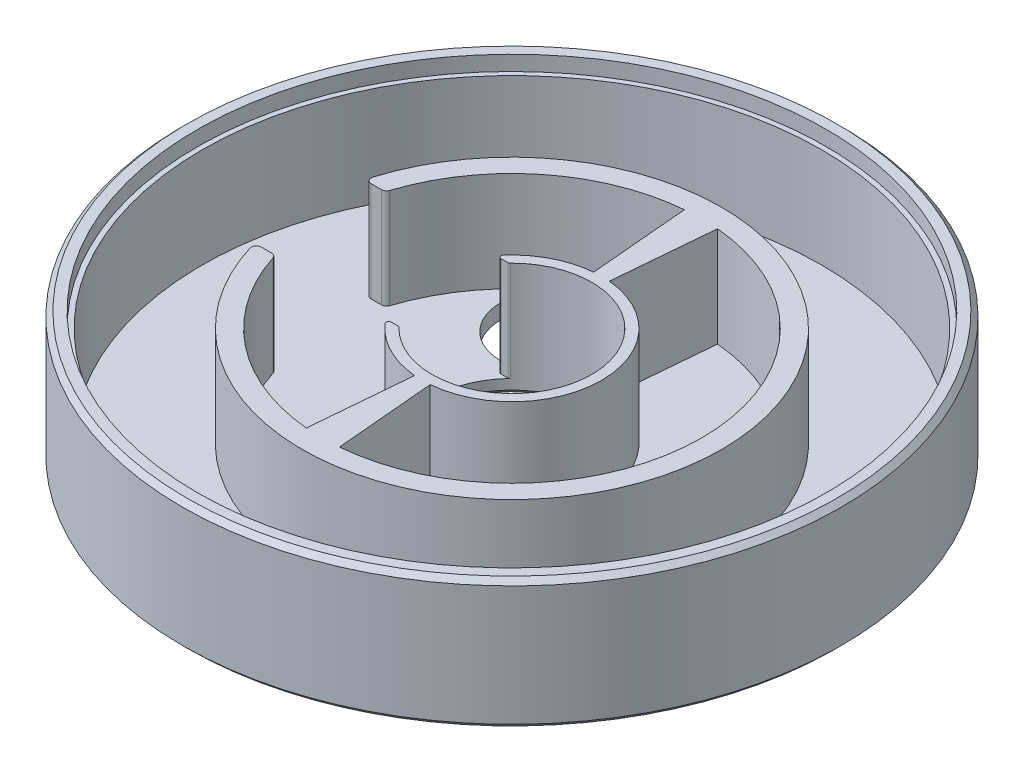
SolidWorks part; units mm, degrees
ref_plane "Front Plane" through (0, 0, 0) normal (0, 0, 1) x (1, 0, 0)
ref_plane "Top Plane" through (0, 0, 0) normal (0, 1, 0) x (1, 0, 0)
ref_plane "Right Plane" through (0, 0, 0) normal (1, 0, 0) x (0, 0, -1)
sketch "Sketch1" plane through (0, 0, 0) normal (0, 1, 0) x (1, 0, 0)
  circle A0 centre (0, 0) radius 8
  circle A1 centre (0, 0) radius 20 construction
  circle A2 centre (0, 0) radius 33
  circle A3 centre (0, 0) radius 14 construction
  circle A4 centre (0, 0) radius 26 construction
extrude "Boss-Extrude1" add sketch "Sketch1" against normal blind 13 contours A2 A1 | A1 A0
sketch "Sketch2" plane through (0, 0, 0) normal (0, 1, 0) x (1, 0, 0)
  circle A0 centre (0, 0) radius 31.5
extrude "Cut-Extrude1" cut sketch "Sketch2" against normal blind 1.5
ref_axis "Axis1" through (0, -13, 0) along (0, 1, 0)
sketch "Sketch4" plane through (0, 0, 0) normal (0, 0, 1) x (1, 0, 0)
  line L0 (-26, 0) -> (-26, -12.929) construction
  line L1 (26, 0) -> (-26, 0) construction
  line L2 (33, 0) -> (-33, 0) construction
  line L3 (-14, 0) -> (-14, -12.929) construction
  line L4 (14, 0) -> (-14, 0) construction
  line L5 (-26, 0) -> (-31, 0)
  line L6 (-31, 0) -> (-31, -11.5)
  line L7 (-31, -11.5) -> (-21, -11.5)
  line L8 (-21, -11.5) -> (-21, 0)
  line L9 (-21, 0) -> (-26, 0)
revolve "Cut-Revolve1" cut sketch "Sketch4" angle 360 about axis through (0, -13, 0) along (0, 1, 0)
sketch "Sketch5" plane through (0, 0, 0) normal (0, 0, 1) x (1, 0, 0)
  line L0 (-14, 0) -> (-19, 0)
  line L1 (26, 0) -> (-26, 0) construction
  line L2 (-19, 0) -> (-19, -11.5)
  line L3 (21, -11.5) -> (-21, -11.5) construction
  line L4 (-19, -11.5) -> (-9, -11.5)
  line L5 (-9, -11.5) -> (-9, 0)
  line L6 (-9, 0) -> (-14, 0)
revolve "Cut-Revolve3" cut sketch "Sketch5" angle 170 mid plane about axis through (0, -13, 0) along (0, 1, 0)
pattern_circular "CirPattern1" count 2 over 360 about axis through (0, 0, 0) along (0, 1, 0) of "Cut-Revolve3"
sketch "Sketch6" plane through (0, 0, 0) normal (1, 0, 0) x (0, 0, -1)
  line L0 (5.5, 0) -> (-5.5, 0)
  line L1 (33, 0) -> (-33, 0) construction
  line L2 (-5.5, 0) -> (-5.5, -11.5)
  line L3 (-5.5, -11.5) -> (5.5, -11.5)
  line L4 (8.9658, -11.5) -> (-8.9658, -11.5) construction
  line L5 (0, 0) -> (0, -11.5) construction
  line L6 (5.5, 0) -> (5.5, -11.5)
extrude "Cut-Extrude2" cut sketch "Sketch6" against normal blind 23
sketch "Sketch7" plane through (0, -11.5, 0) normal (0, 1, 0) x (1, 0, 0)
  circle A0 centre (14, 0) radius 5
  circle A1 centre (0, 0) radius 14 construction
  circle A2 centre (-7.7849, 11.6359) radius 5
extrude "Cut-Extrude3" cut sketch "Sketch7" against normal through all
chamfer "Chamfer1" distance 0.5 angle 45 2 edges at (0, -13, 33) (0, 0, 33)
chamfer "Chamfer2" distance 0.5 angle 45 1 edges at (0, -13, 8)
fillet "Fillet1" radius 0.25 2 edges at (-7.1239, -6.5, -5.5) (-5.8095, -6.5, -5.5)
fillet "Fillet2" radius 0.25 2 edges at (-7.1239, -6.5, 5.5) (-5.8095, -6.5, 5.5)
fillet "Fillet3" radius 0.5 4 edges at (-20.267, -6.5, 5.5) (-18.1865, -6.5, 5.5) (-20.267, -6.5, -5.5) (-18.1865, -6.5, -5.5)
